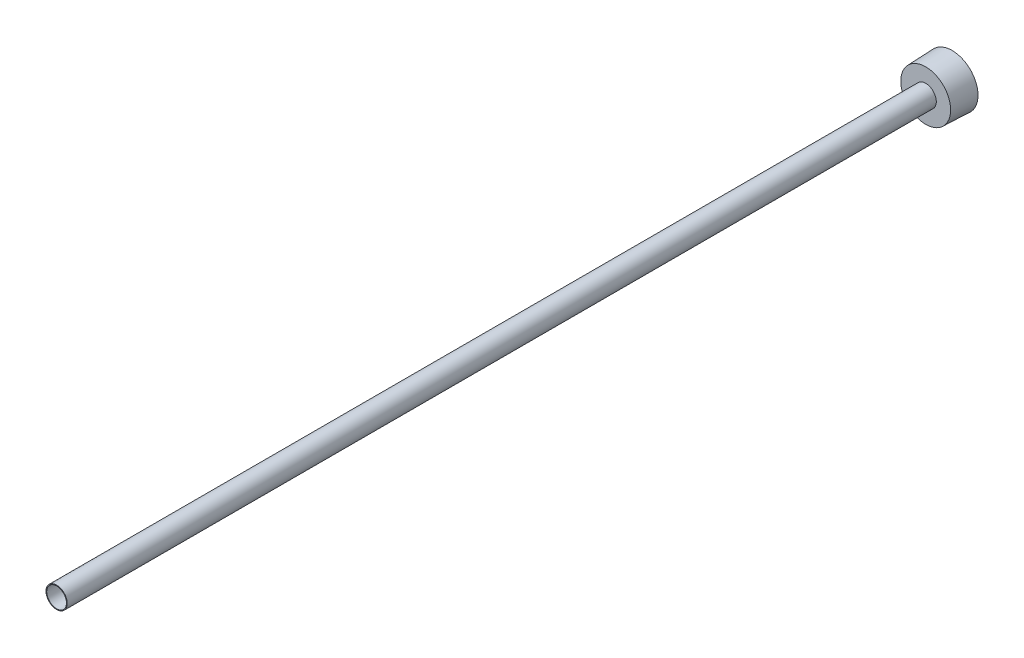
SolidWorks part; units mm, degrees
ref_plane "Front Plane" through (0, 0, 0) normal (0, 0, 1) x (1, 0, 0)
ref_plane "Top Plane" through (0, 0, 0) normal (0, 1, 0) x (1, 0, 0)
ref_plane "Right Plane" through (0, 0, 0) normal (1, 0, 0) x (0, 0, -1)
sketch "Sketch1" plane through (0, 0, 0) normal (1, 0, 0) x (0, 0, -1)
  line L0 (-278.0011, 0) -> (49721.9989, 0) construction
  line L1 (-457.2, 0) -> (0, 0)
  line L6 (0, 0) -> (0, 13.2207)
  line L7 (0, 13.2207) -> (-13.4874, 12.7287)
  line L8 (-13.4874, 12.7287) -> (-13.4874, 5.4229)
  line L9 (-13.4874, 5.4229) -> (-457.2, 5.4229)
  line L10 (-457.2, 5.4229) -> (-457.2, 0)
  dimension "D1" = 13.4874
  dimension "D2" = 26.4414
  dimension "D3" = 2.089
  dimension "D4" = 10.8458
  dimension "D5" = 457.2
revolve "Revolve1" add sketch "Sketch1" angle 360 about L0
sketch "Sketch2" plane through (0, 0, 457.2) normal (0, 0, 1) x (1, 0, 0)
  circle A0 centre (0, 0) radius 5.0419
  dimension "D1" = 10.0838
extrude "Cut-Extrude1" cut sketch "Sketch2" against normal through all
sketch "Sketch3" plane through (0, 0, 0) normal (0, 0, -1) x (-1, 0, 0)
  line L0 (0, 14.5428) -> (0, -14.5428) construction
  line L1 (-9.525, -5.4993) -> (0, -10.9985)
  line L2 (0, -10.9985) -> (9.525, -5.4993)
  line L3 (9.525, -5.4993) -> (9.525, 5.4993)
  line L4 (9.525, 5.4993) -> (0, 10.9985)
  line L5 (0, 10.9985) -> (-9.525, 5.4993)
  line L6 (-9.525, 5.4993) -> (-9.525, -5.4993)
  circle A0 centre (0, 0) radius 9.525 construction
  dimension "D1" = 19.05
extrude "Cut-Extrude2" cut sketch "Sketch3" against normal blind 9.525
